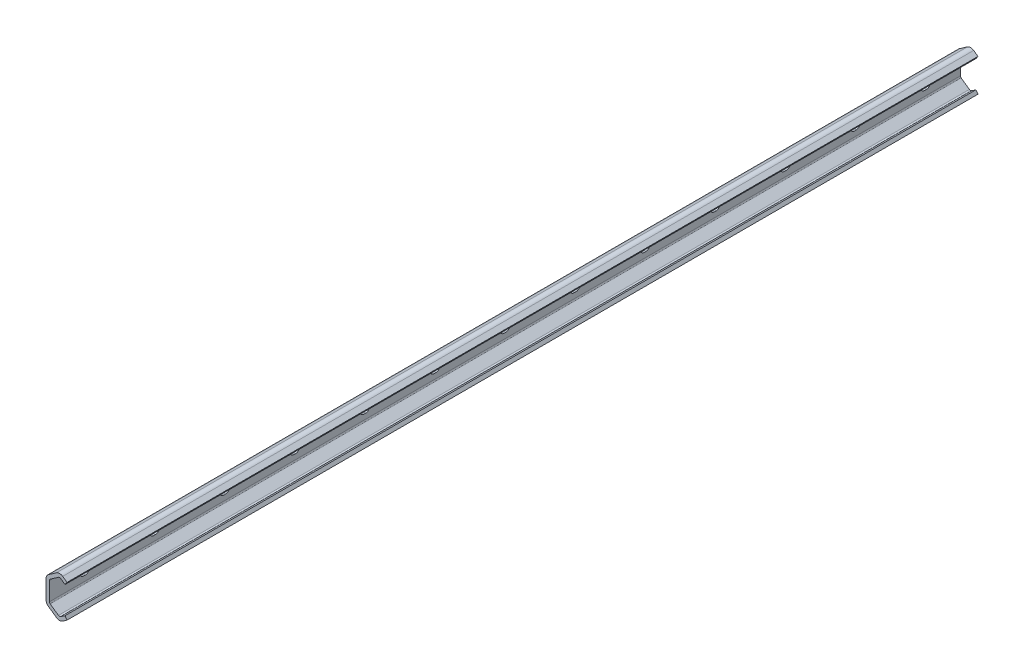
SolidWorks part; units mm, degrees
ref_plane "Front Plane" through (0, 0, 0) normal (0, 0, 1) x (1, 0, 0)
ref_plane "Top Plane" through (0, 0, 0) normal (0, 1, 0) x (1, 0, 0)
ref_plane "Right Plane" through (0, 0, 0) normal (1, 0, 0) x (0, 0, -1)
sketch "Sketch1" plane through (0, 0, 0) normal (0, 0, 1) x (1, 0, 0)
  line L0 (21.7057, -15.4016) -> (24, -18.6782)
  line L1 (24, -18.6782) -> (19.0362, -22.1539)
  line L2 (11.9638, -22.1539) -> (3.3719, -16.1378)
  line L3 (0, -10.44) -> (0, 10.44)
  line L4 (3.3719, 16.1378) -> (11.9638, 22.1539)
  line L5 (19.0362, 22.1539) -> (24, 18.6782)
  line L6 (24, 18.6782) -> (21.7057, 15.4016)
  line L7 (21.7057, 15.4016) -> (16.814, 18.8268)
  line L8 (14.186, 18.8268) -> (4.7304, 12.206)
  line L9 (4.7304, -12.206) -> (14.186, -18.8268)
  line L10 (4, 10.44) -> (4, -10.44)
  line L11 (16.814, -18.8268) -> (21.7057, -15.4016)
  arc A0 (19.0362, -22.1539) -> (11.9638, -22.1539) centre (15.5, -17.1036) cw
  arc A1 (0, -10.44) -> (3.3719, -16.1378) centre (6.5, -10.44) ccw
  arc A2 (0, 10.44) -> (3.3719, 16.1378) centre (6.5, 10.44) cw
  arc A3 (11.9638, 22.1539) -> (19.0362, 22.1539) centre (15.5, 17.1036) cw
  arc A4 (16.814, 18.8268) -> (14.186, 18.8268) centre (15.5, 16.9503) ccw
  arc A5 (4.7304, 12.206) -> (4, 10.44) centre (5.7497, 10.7503) ccw
  arc A6 (4, -10.44) -> (4.7304, -12.206) centre (6.5, -10.44) ccw
  arc A7 (14.186, -18.8268) -> (16.814, -18.8268) centre (15.5, -16.9503) ccw
  dimension "D1" = 6.1652
  dimension "D2" = 6.5
  dimension "D3" = 6.5
  dimension "D4" = 6.1652
  dimension "D5" = 2.2909
  dimension "D6" = 1.777
  dimension "D7" = 2.5
  dimension "D8" = 2.2909
  dimension "D9" = 3.3719
  dimension "D10" = 3.3719
  dimension "D11" = 4
  dimension "D12" = 4.7304
  dimension "D13" = 4.7304
  dimension "D14" = 5.7497
  dimension "D15" = 6.5
  dimension "D16" = 11.9638
  dimension "D17" = 14.186
  dimension "D18" = 15.5
  dimension "D19" = 11.9638
  dimension "D20" = 15.5
  dimension "D21" = 14.186
  dimension "D22" = 16.814
  dimension "D23" = 10.44
  dimension "D24" = 10.44
  dimension "D25" = 16.814
  dimension "D29" = 21.7057
  dimension "D30" = 21.7057
  dimension "D31" = 24
  dimension "D32" = 24
extrude "Extrude1" add sketch "Sketch1" against normal blind 1040
sketch "Sketch2" plane through (4, 0, 0) normal (1, 0, 0) x (0, 0, -1)
  line L0 (39, 0) -> (41, 0) construction
  line L1 (39, 4.5) -> (41, 4.5)
  line L2 (39, -4.5) -> (41, -4.5)
  arc A0 (39, 4.5) -> (39, -4.5) centre (39, 0) ccw
  arc A1 (41, 4.5) -> (41, -4.5) centre (41, 0) cw
  point P7 (40, 0)
  dimension "D1" = 2
  dimension "D2" = 9
  dimension "D3" = 40
extrude "Extrude2" cut sketch "Sketch2" against normal through all
pattern_linear "LPattern1" count 13 spacing 80 along (0, 0, -1) of "Extrude2"
